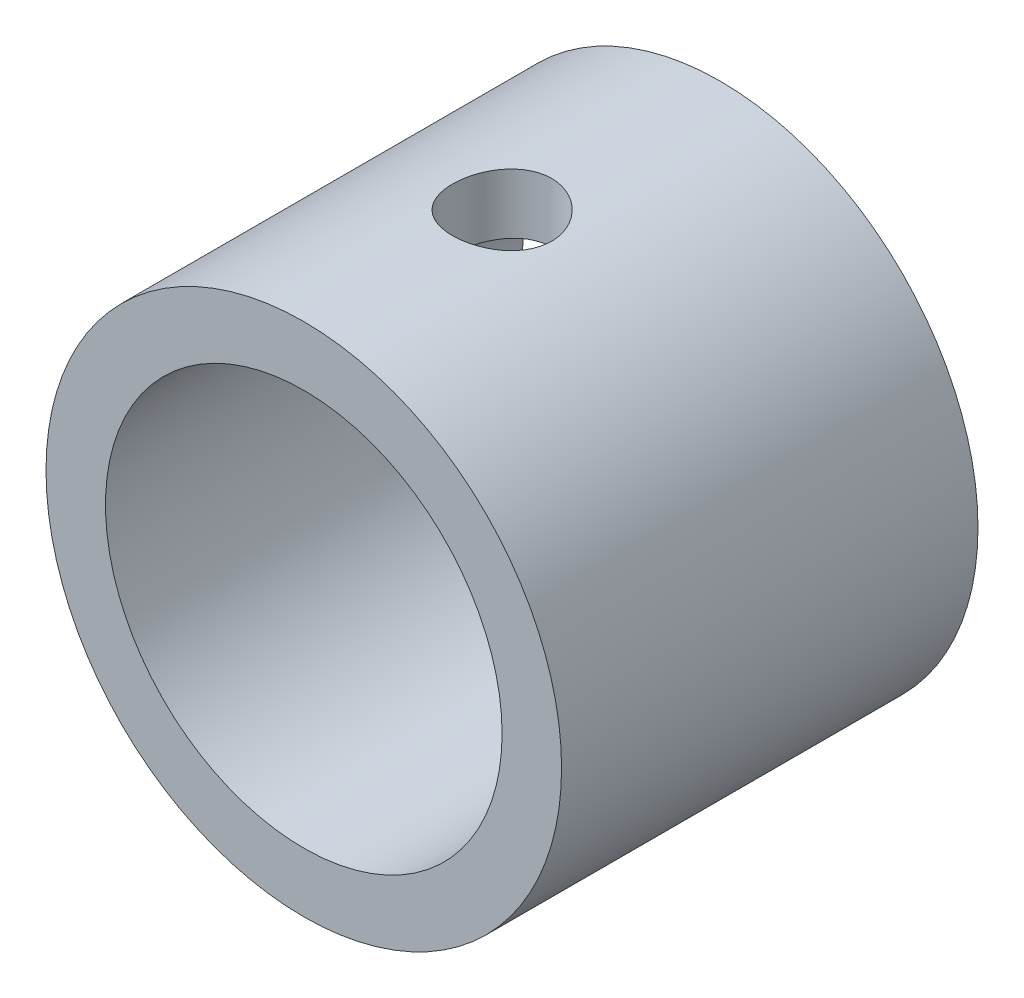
SolidWorks part; units mm, degrees
ref_plane "Plan de face" through (0, 0, 0) normal (0, 0, 1) x (1, 0, 0)
ref_plane "Plan de dessus" through (0, 0, 0) normal (0, 1, 0) x (1, 0, 0)
ref_plane "Plan de droite" through (0, 0, 0) normal (1, 0, 0) x (0, 0, -1)
sketch "Esquisse1" plane through (0, 0, 0) normal (0, 0, 1) x (1, 0, 0)
  circle A0 centre (0, 0) radius 10
  circle A1 centre (0, 0) radius 13
  dimension "D1" = 20
  dimension "D2" = 26
extrude "Extrusion1" add sketch "Esquisse1" along normal blind 21
hole_wizard "Trou taraudé M61" positions "Esquisse3" profile "Esquisse2" tap size "M6" standard "ISO"
sketch "Esquisse3" plane through (0, 0, 0) normal (0, 1, 0) x (1, 0, 0)
  line L0 (-13, -21) -> (13, -21) construction
  point P0 (0, -11)
  dimension "D1" = 10
sketch "Esquisse2" plane through (0, 0, 11) normal (1, 0, 0) x (0, 0, -1)
  line L0 (0, 0) -> (0, 13)
  line L1 (0, 13) -> (2.5, 13)
  line L2 (2.5, 13) -> (2.5, 0)
  line L5 (2.5, 0) -> (0, 0)
  line L11 (0, -6.35) -> (0, 107.95) construction
  dimension "Diamètre du trou pour taraudage jusqu'au prochain" = 5
  dimension "Profondeur du trou pour taraudage jusqu'au prochain" = 13
